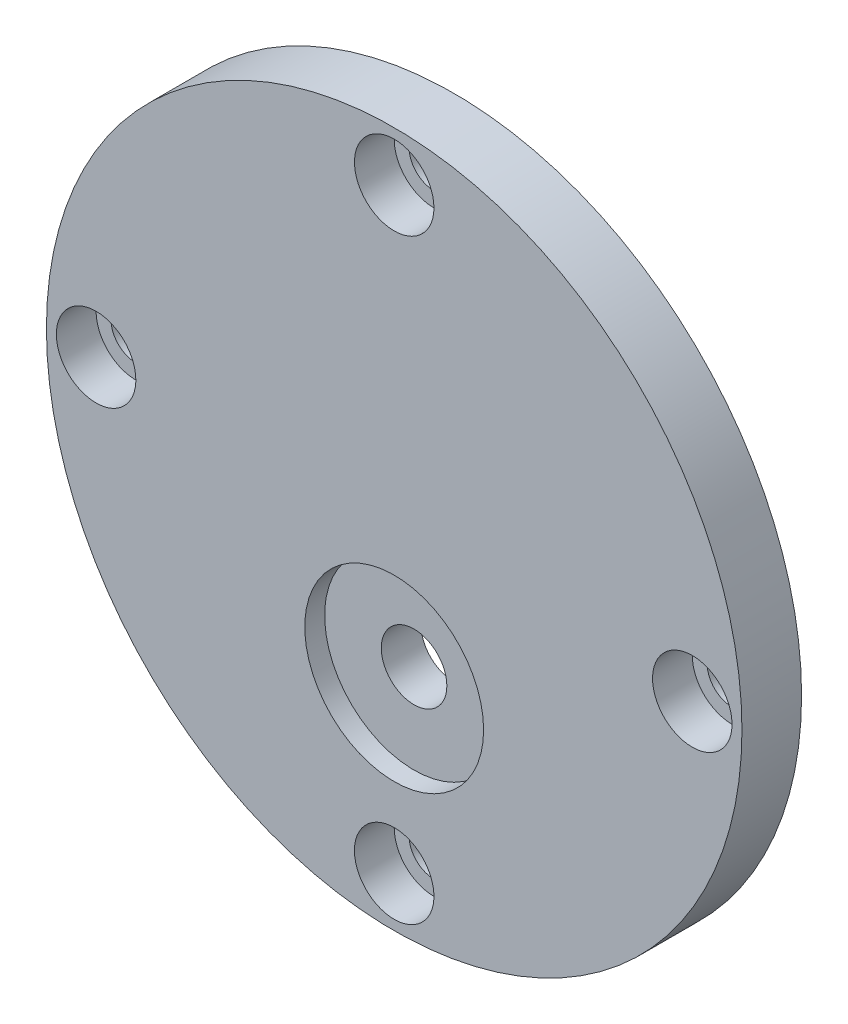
SolidWorks part; units mm, degrees
ref_plane "face" through (0, 0, 0) normal (0, 0, 1) x (1, 0, 0)
ref_plane "dessus" through (0, 0, 0) normal (0, 1, 0) x (1, 0, 0)
ref_plane "profil" through (0, 0, 0) normal (1, 0, 0) x (0, 0, -1)
sketch "Esquisse1" plane through (0, 0, 0) normal (0, 0, 1) x (1, 0, 0)
  circle A0 centre (0, 0) radius 35
  dimension "D1" = 70
extrude "Base-Extrusion" add sketch "Esquisse1" along normal blind 6
sketch "Esquisse2" plane through (0, 0, 6) normal (0, 0, 1) x (1, 0, 0)
  circle A0 centre (0, 30) radius 4
  circle A1 centre (0, 0) radius 35 construction
  dimension "D1" = 8
  dimension "D2" = 30
extrude "Enlèv. mat.-Extru.1" cut sketch "Esquisse2" against normal blind 4
sketch "Esquisse3" plane through (0, 0, 2) normal (0, 0, 1) x (1, 0, 0)
  circle A0 centre (0, 30) radius 2.5
  dimension "D1" = 5
extrude "Enlèv. mat.-Extru.2" cut sketch "Esquisse3" against normal through all
pattern_circular "Répétition circulaire1" count 4 over 360
sketch "Esquisse4" plane through (0, 0, 6) normal (0, 0, 1) x (1, 0, 0)
  circle A0 centre (0, -13) radius 9
  circle A2 centre (0, 0) radius 35 construction
  dimension "D1" = 13
  dimension "D3" = 18
extrude "Enlèv. mat.-Extru.3" cut sketch "Esquisse4" against normal blind 2
hole_wizard "Trou taraudé M8x1.251" positions "Esquisse6" profile "Esquisse5" tap size "M8x1.25" standard "Ansi Métrique"
sketch "Esquisse6" plane through (0, 0, 4) normal (0, 0, 1) x (1, 0, 0)
  point P0 (0, -13)
sketch "Esquisse5" plane through (0, -13, 4) normal (1, 0, 0) x (0, -1, 0)
  line L0 (0, 0) -> (0, 4)
  line L1 (0, 4) -> (3.3, 4)
  line L2 (3.3, 4) -> (3.3, 0)
  line L5 (3.3, 0) -> (0, 0)
  line L11 (0, -6.35) -> (0, 107.95) construction
  dimension "Diamètre du perçage jusqu'au prochain" = 6.6
  dimension "Profondeur du perçage jusqu'au prochain" = 4
